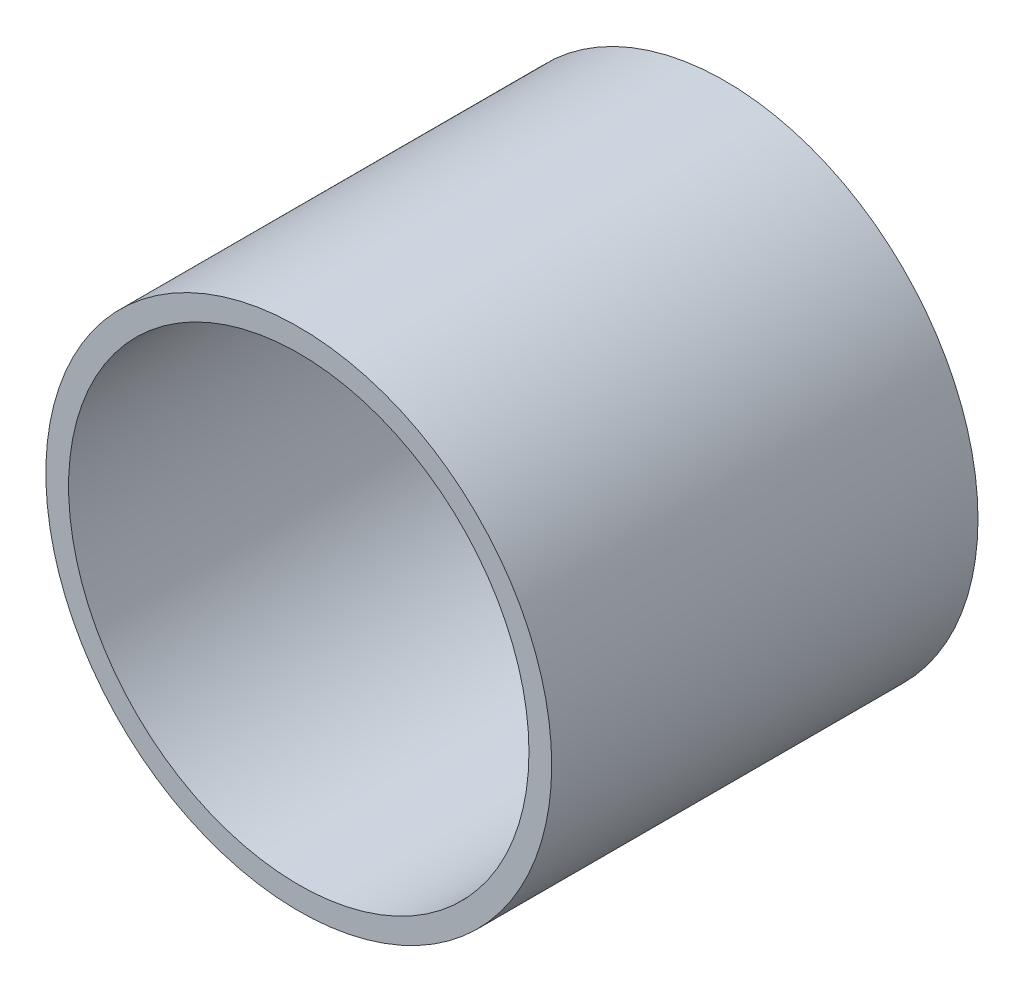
SolidWorks part; units mm, degrees
ref_plane "Plan de face" through (0, 0, 0) normal (0, 0, 1) x (1, 0, 0)
ref_plane "Plan de dessus" through (0, 0, 0) normal (0, 1, 0) x (1, 0, 0)
ref_plane "Plan de droite" through (0, 0, 0) normal (1, 0, 0) x (0, 0, -1)
sketch "Esquisse1" plane through (0, 0, 0) normal (0, 0, 1) x (1, 0, 0)
  line L0 (0, 0) -> (0, 8.383) construction
  line L1 (0, 0) -> (0.9732, 9.1513) construction
  line L2 (0.8566, 8.0546) -> (0.9412, 8.8501) construction
  line L3 (0, 8.1) -> (0, 8.9) construction
  circle A0 centre (0, 0) radius 8.5 construction
  arc A1 (0, 8.9) -> (0.9412, 8.8501) centre (0, 0) ccw construction
  arc A2 (0, 8.1) -> (0.8566, 8.0546) centre (0, 0) ccw construction
  circle A3 centre (0, 0) radius 8.1 construction
  circle A4 centre (0, 0) radius 8.9 construction
  circle A5 centre (0, 0) radius 8.1
  circle A6 centre (0, 0) radius 8.9
  dimension "D1" = 0.4
  dimension "D2" = 0.4
extrude "Extrusion1" add sketch "Esquisse1" along normal blind 15
